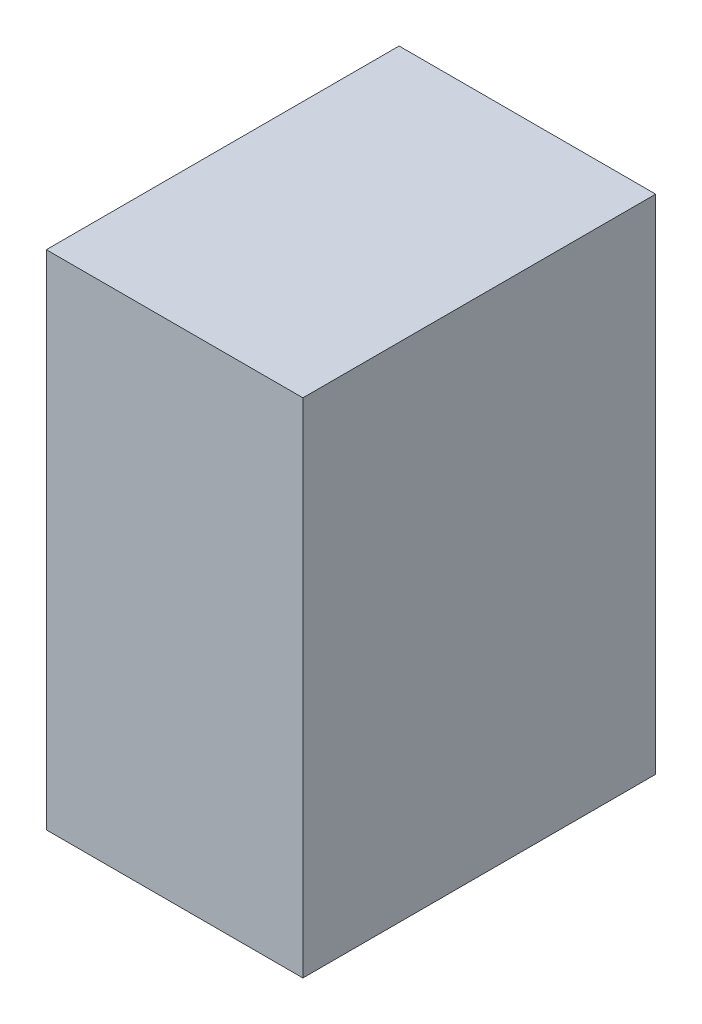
SolidWorks part; units mm, degrees
ref_plane "Спереди" through (0, 0, 0) normal (0, 0, 1) x (1, 0, 0)
ref_plane "Сверху" through (0, 0, 0) normal (0, 1, 0) x (1, 0, 0)
ref_plane "Справа" through (0, 0, 0) normal (1, 0, 0) x (0, 0, -1)
sketch "Эскиз1" plane through (0, 0, 0) normal (0, 0, 1) x (1, 0, 0)
  line L0 (0, 230) -> (0, -240) construction
  line L1 (-120, 230) -> (120, 230)
  line L2 (-120, 230) -> (-120, -240)
  line L3 (-120, -240) -> (120, -240)
  line L4 (120, 230) -> (120, -240)
  circle A0 centre (0, -33.2618) radius 88 construction
  circle A1 centre (0, 117.3523) radius 52 construction
  point P0 (0, -33.2618)
  dimension "D2" = 470
extrude "Бобышка-Вытянуть1" add sketch "Эскиз1" along normal blind 330
